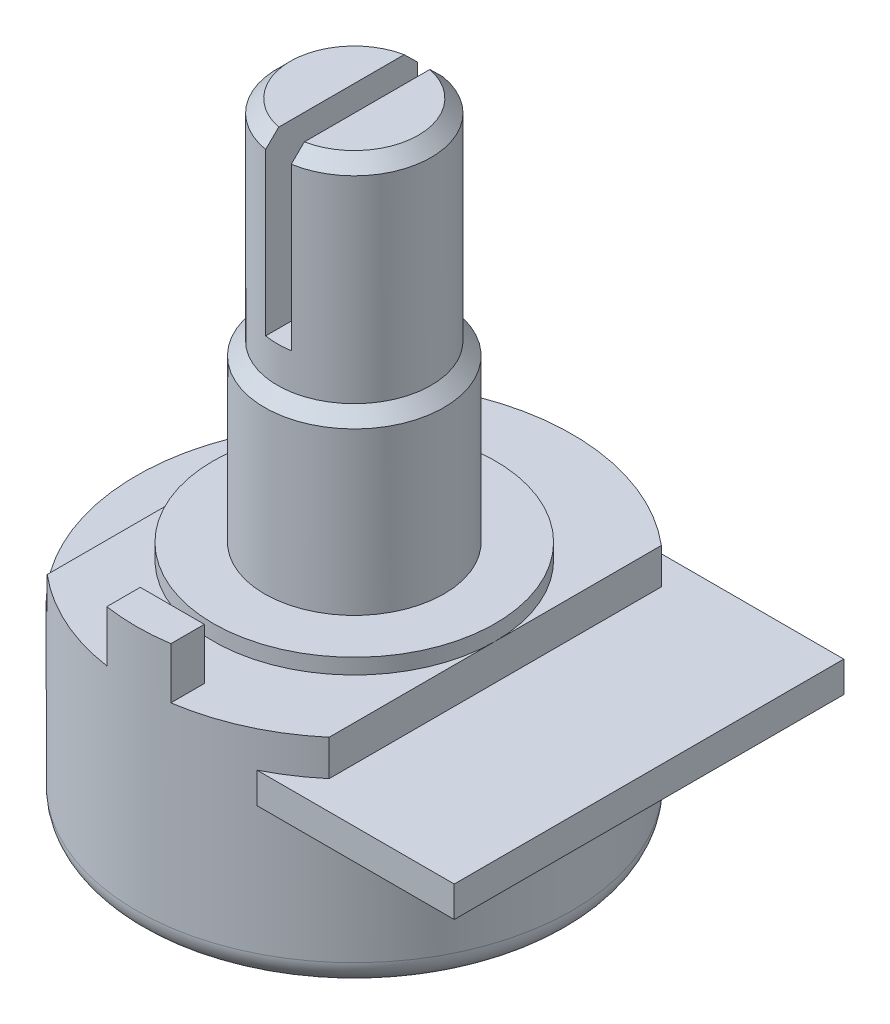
SolidWorks part; units mm, degrees
ref_plane "Přední rovina" through (0, 0, 0) normal (0, 0, 1) x (1, 0, 0)
ref_plane "Horní rovina" through (0, 0, 0) normal (0, 1, 0) x (1, 0, 0)
ref_plane "Pravá rovina" through (0, 0, 0) normal (1, 0, 0) x (0, 0, -1)
sketch "Skica1" plane through (0, 0, 0) normal (0, 0, 1) x (1, 0, 0)
  line L0 (0, 22.2532) -> (0, -9.3417) construction
  line L1 (0, 0) -> (-8.5, 0)
  line L2 (-8.5, 0) -> (-8.5, 6)
  line L3 (-8.5, 6) -> (0, 6)
  line L4 (0, 6) -> (0, 0)
  dimension "D1" = 17
  dimension "D2" = 6
revolve "Rotovat1" add sketch "Skica1" angle 360 about L0
fillet "Zaoblit1" radius 1 1 edges at (0, 0, 8.5)
sketch "Skica2" plane through (0, 6, 0) normal (0, 1, 0) x (1, 0, 0)
  line L0 (0, 0) -> (20.6722, 0) construction
  line L1 (11.5, -7.6) -> (11.5, 7.6)
  line L2 (11.5, 7.6) -> (3.8066, 7.6)
  line L3 (11.5, -7.6) -> (3.8066, -7.6)
  circle A1 centre (0, 0) radius 8.5
  arc A2 (3.8066, 7.6) -> (3.8066, -7.6) centre (0, 0) ccw
  point P9 (11.5, 0)
  dimension "D2" = 20
  dimension "D3" = 15.2
  dimension "D1" = 0
extrude "Přidat vysunutím1" add sketch "Skica2" along normal blind 1.2
sketch "Skica3" plane through (0, 7.2, 0) normal (0, 1, 0) x (1, 0, 0)
  line L0 (0, 8.5) -> (0, -8.5) construction
  line L1 (-5.5, 6.4807) -> (-5.5, -6.4807)
  line L2 (5.5, 6.4807) -> (5.5, -6.4807)
  line L3 (11.5, 7.6) -> (3.8066, 7.6)
  line L4 (3.8066, -7.6) -> (11.5, -7.6)
  line L5 (11.5, -7.6) -> (11.5, 7.6)
  arc A0 (-5.5, -6.4807) -> (5.5, -6.4807) centre (0, 0) ccw
  arc A1 (3.8066, 7.6) -> (3.8066, -7.6) centre (0, 0) ccw
  arc A2 (5.5, 6.4807) -> (-5.5, 6.4807) centre (0, 0) ccw
  dimension "D2" = 11
  dimension "D1" = 0
extrude "Přidat vysunutím2" add sketch "Skica3" along normal blind 1.4
sketch "Skica4" plane through (0, 8.6, 0) normal (0, 1, 0) x (1, 0, 0)
  circle A0 centre (0, 0) radius 5.5
extrude "Přidat vysunutím3" add sketch "Skica4" along normal blind 0.6
sketch "Skica5" plane through (0, 9.2, 0) normal (0, 1, 0) x (1, 0, 0)
  circle A0 centre (0, 0) radius 3.5
  dimension "D1" = 7
extrude "Přidat vysunutím4" add sketch "Skica5" along normal offset from surface (6.8 mm away) 16
sketch "Skica6" plane through (0, 16, 0) normal (0, 1, 0) x (1, 0, 0)
  circle A0 centre (0, 0) radius 3
  dimension "D1" = 6
extrude "Přidat vysunutím5" add sketch "Skica6" along normal blind 8.2
sketch "Skica7" plane through (0, 8.6, 0) normal (0, 1, 0) x (1, 0, 0)
  line L0 (0, 0) -> (0, -9.0624) construction
  line L1 (-1.25, -8.4076) -> (-1.25, -7.1)
  line L2 (-1.25, -7.1) -> (1.25, -7.1)
  line L3 (1.25, -8.4076) -> (1.25, -7.1)
  arc A0 (-5.5, -6.4807) -> (5.5, -6.4807) centre (0, 0) ccw construction
  arc A1 (-1.25, -8.4076) -> (1.25, -8.4076) centre (0, 0) ccw
  point P8 (0, -7.1)
  dimension "D1" = 2.5
  dimension "D2" = 1.4
extrude "Přidat vysunutím6" add sketch "Skica7" along normal blind 2
chamfer "Zkosení1" distance 0.5 angle 45 1 edges at (0, 24.2, 3)
sketch "Skica8" plane through (0, 0, 0) normal (0, 0, 1) x (1, 0, 0)
  line L0 (0, 0) -> (0, 26.7075) construction
  line L1 (3, 24.2) -> (-3, 24.2) construction
  line L2 (-0.5, 17.4) -> (0.5, 17.4)
  line L3 (-0.5, 17.4) -> (-0.5, 24.2)
  line L4 (-0.5, 24.2) -> (0.5, 24.2)
  line L5 (0.5, 17.4) -> (0.5, 24.2)
  line L6 (-0.5, 17.4) -> (0.5, 24.2) construction
  line L7 (-0.5, 24.2) -> (0.5, 17.4) construction
  point P3 (0, 20.8)
  dimension "D1" = 6.8
  dimension "D2" = 1
extrude "Odebrat vysunutím1" cut sketch "Skica8" against normal through all both and the other way through all
chamfer "Zkosení2" distance 0.5 angle 45 1 edges at (0, 16, -3.5)
